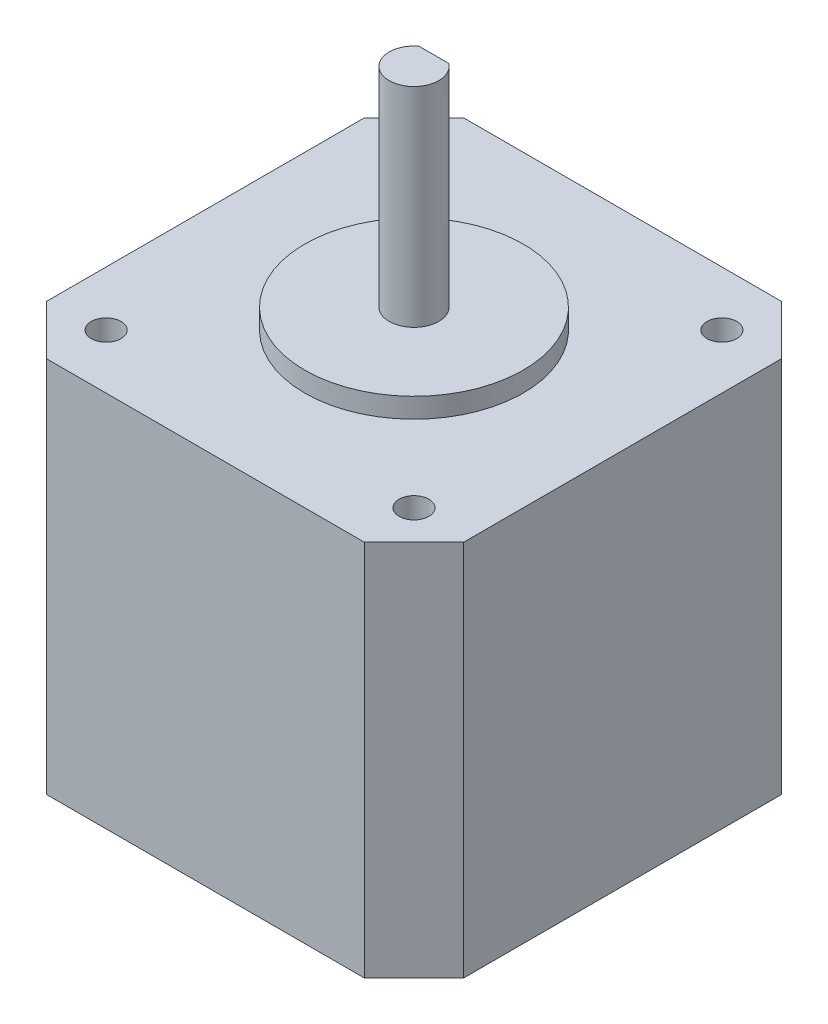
SolidWorks part; units mm, degrees
ref_plane "Piano frontale" through (0, 0, 0) normal (0, 0, 1) x (1, 0, 0)
ref_plane "Piano superiore" through (0, 0, 0) normal (0, 1, 0) x (1, 0, 0)
ref_plane "Piano destro" through (0, 0, 0) normal (1, 0, 0) x (0, 0, -1)
sketch "Schizzo1" plane through (0, 0, 0) normal (0, 1, 0) x (1, 0, 0)
  line L1 (21, -21) -> (-21, -21)
  line L2 (21, -21) -> (21, 21)
  line L3 (21, 21) -> (-21, 21)
  line L4 (-21, -21) -> (-21, 21)
  line L5 (21, -21) -> (-21, 21) construction
  line L6 (21, 21) -> (-21, -21) construction
  point P0 (0, 0)
  dimension "D1" = 42
  dimension "D2" = 42
extrude "Estrusione-Estrusione1" add sketch "Schizzo1" along normal blind 38
sketch "Schizzo2" plane through (0, 38, 0) normal (0, 1, 0) x (1, 0, 0)
  circle A0 centre (0, 0) radius 11
  dimension "D1" = 22
extrude "Estrusione-Estrusione2" add sketch "Schizzo2" along normal blind 2
sketch "Schizzo3" plane through (0, 40, 0) normal (0, 1, 0) x (1, 0, 0)
  circle A0 centre (0, 0) radius 2.5
  dimension "D1" = 5
extrude "Estrusione-Estrusione3" add sketch "Schizzo3" along normal blind 21
sketch "Schizzo5" plane through (0, 38, 0) normal (0, 1, 0) x (1, 0, 0)
  line L0 (0, 0) -> (-25.5259, 0) construction
  line L1 (0, 0) -> (0, 22.2736) construction
  circle A0 centre (-15.5, 15.5) radius 1.5
  circle A1 centre (15.5, 15.5) radius 1.5
  circle A2 centre (15.5, -15.5) radius 1.5
  circle A3 centre (-15.5, -15.5) radius 1.5
  dimension "D3" = 3
  dimension "D1" = 15.5
  dimension "D2" = 15.5
extrude "Taglio-Estrusione8" cut sketch "Schizzo5" against normal blind 10
chamfer "Smusso1" distance 5 angle 45 4 edges at (21, 19, -21) (21, 19, 21) (-21, 19, 21) (-21, 19, -21)
sketch "Schizzo6" plane through (0, 61, 0) normal (0, 1, 0) x (1, 0, 0)
  line L0 (-3.4579, 2) -> (3.4579, 2)
  line L1 (-3.4579, 2) -> (-3.4579, 3.5694)
  line L2 (-3.4579, 3.5694) -> (3.4579, 3.5694)
  line L3 (3.4579, 3.5694) -> (3.4579, 2)
  circle A0 centre (0, 0) radius 2.5 construction
  point P4 (0, 2)
  dimension "D1" = 4.5
  dimension "D2" = 6.9158
  dimension "D3" = 1.5694
extrude "Taglio-Estrusione9" cut sketch "Schizzo6" against normal blind 19
